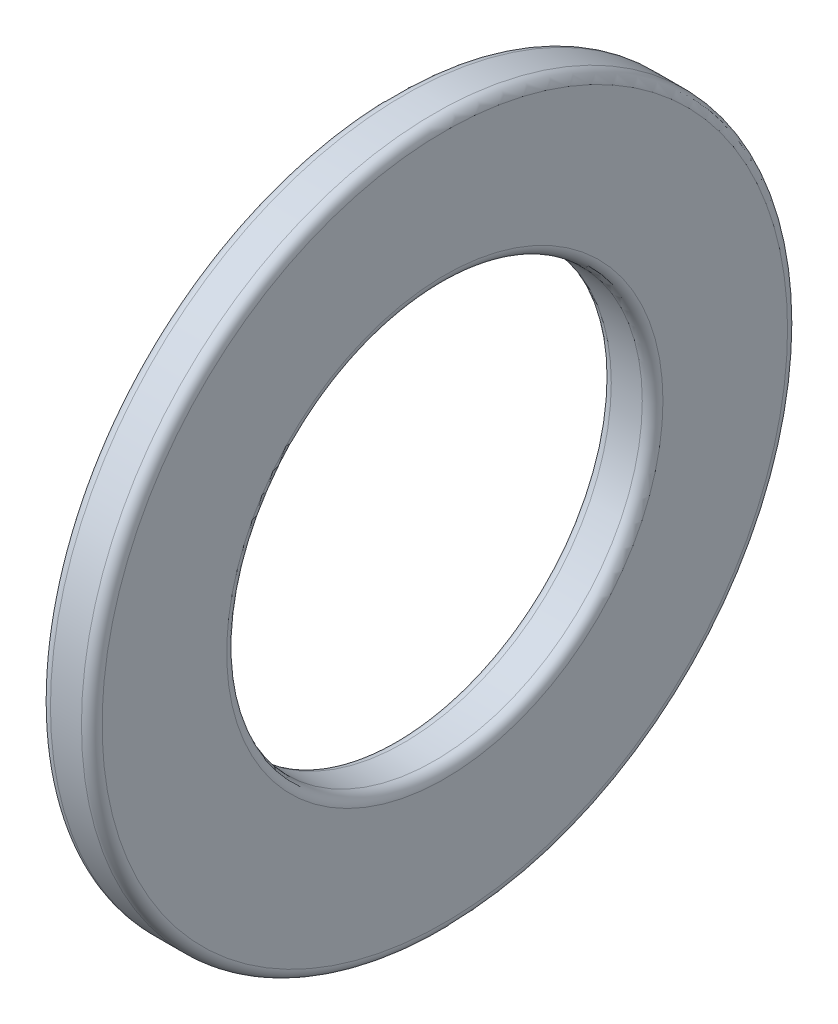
SolidWorks part; units mm, degrees
ref_plane "Front Plane" through (0, 0, 0) normal (0, 0, 1) x (1, 0, 0)
ref_plane "Top Plane" through (0, 0, 0) normal (0, 1, 0) x (1, 0, 0)
ref_plane "Right Plane" through (0, 0, 0) normal (1, 0, 0) x (0, 0, -1)
sketch "Sketch3" plane through (0, 0, 0) normal (0, 0, 1) x (1, 0, 0)
  line L0 (-0.8128, 0) -> (0.8128, 0) construction
  line L1 (0, -11.1125) -> (0, 11.1125) construction
  line L2 (0, -6.5405) -> (0, 6.5405) construction
  line L4 (0.8128, -11.1125) -> (-0.8128, -11.1125)
  line L5 (0.8128, -11.1125) -> (0.8128, 11.1125)
  line L6 (0.8128, 11.1125) -> (-0.8128, 11.1125)
  line L7 (-0.8128, -11.1125) -> (-0.8128, 11.1125)
  line L8 (0, 11.1125) -> (0, -11.1125) construction
  line L9 (0.8128, 0) -> (-0.8128, 0) construction
  point P0 (0, 0)
  point P4 (0, 0)
  point P8 (0, 0)
  point P11 (0, 0)
sketch "Sketch1" plane through (0, 0, 0) normal (1, 0, 0) x (0, 0, -1)
  circle A0 centre (0, 0) radius 11.1125
  circle A1 centre (0, 0) radius 6.5405
extrude "Boss-Extrude1" add sketch "Sketch1" along normal mid plane 1.6256
fillet "Fillet1" radius 0.3251 4 edges at (0.8128, 0, -11.1125) (-0.8128, 0, -11.1125) (0.8128, 0, -6.5405) (-0.8128, 0, -6.5405)
sketch "Sketch4" plane through (-0.8128, 0, 0) normal (-1, 0, 0) x (0, 0, 1)
  line L0 (0, -11.1125) -> (0, 11.1125) construction
  line L1 (0, -11.1125) -> (0, 11.1125) construction
  circle A0 centre (0, 0) radius 6.5405 construction
  circle A1 centre (0, 0) radius 11.1125 construction
  circle A2 centre (0, 0) radius 6.5405 construction
  circle A3 centre (0, 0) radius 11.1125 construction
  point P0 (0, -6.5405)
  point P1 (0, 6.5405)
  point P5 (-11.1125, 0)
  point P9 (-6.5405, 0)
  point P10 (6.5405, 0)
  point P11 (11.1125, 0)
equation "\"D1@Boss-Extrude1\" = \"Thickness@Sketch3\""
equation "\"D1@Fillet1\"=\"Thickness@Sketch3\"*.2"
